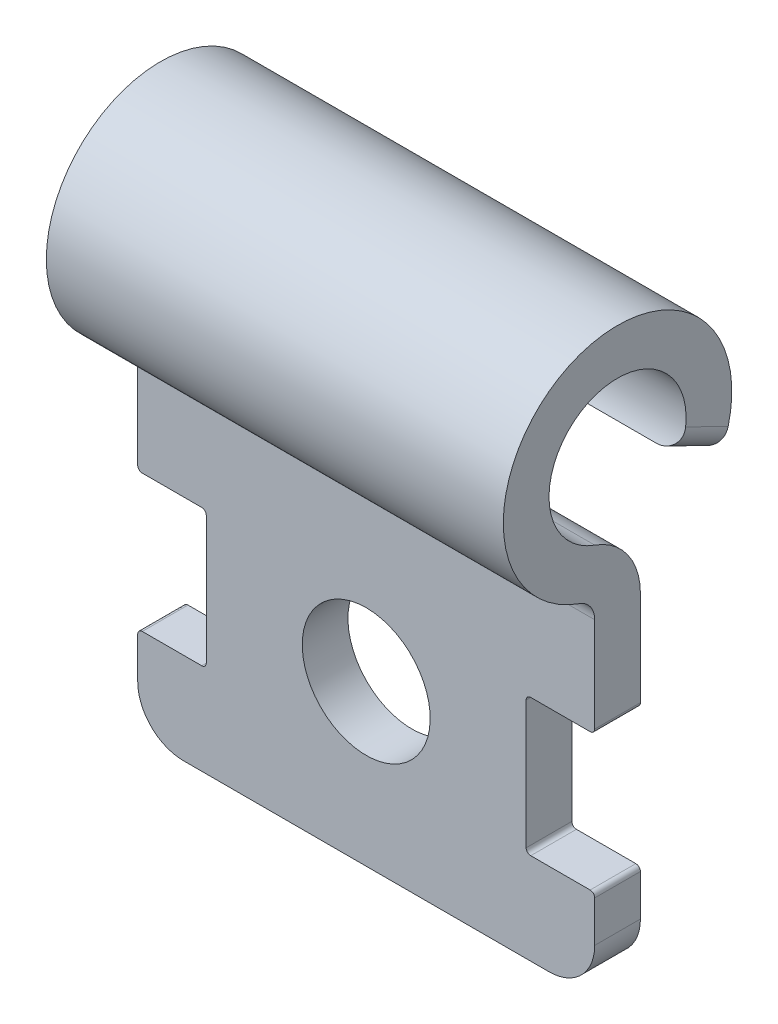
SolidWorks part; units mm, degrees
ref_plane "Front Plane" through (0, 0, 0) normal (0, 0, 1) x (1, 0, 0)
ref_plane "Top Plane" through (0, 0, 0) normal (0, 1, 0) x (1, 0, 0)
ref_plane "Right Plane" through (0, 0, 0) normal (1, 0, 0) x (0, 0, -1)
sketch "Sketch1" plane through (0, 0, 0) normal (1, 0, 0) x (0, 0, -1)
  line L1 (-0.5, -2.8284) -> (-0.5, -10)
  arc A0 (2.247, -1.0959) -> (-0.8333, -2.357) centre (0, 0) ccw
  arc A1 (-0.5, -2.8284) -> (-0.8333, -2.357) centre (-1, -2.8284) ccw
  point P5 (2.247, -1.0959)
  dimension "D" = 5
  dimension "D4" = 0.5
  dimension "C" = 10
  dimension "t/2" = 0.5
extrude "Extrude-Thin1" add sketch "Sketch1" along normal blind 10 thin
sketch "Sketch2" plane through (0, 0, -0.5) normal (0, 0, -1) x (-1, 0, 0)
  line L0 (-5, -10) -> (-5, -4.3792) construction
  line L1 (-10, -10) -> (0, -10) construction
  circle A1 centre (-5, -6.5) radius 1.4
  dimension "D3" = 2.8
  dimension "E" = 6.5
extrude "Cut-Extrude1" cut sketch "Sketch2" against normal through all
sketch "Sketch3" plane through (0, 0, 0.5) normal (0, 0, 1) x (1, 0, 0)
  line L0 (0, -2.8284) -> (0, -10) construction
  line L1 (0, -8) -> (1.5, -8)
  line L2 (0, -8) -> (0, -5)
  line L3 (0, -5) -> (1.5, -5)
  line L4 (1.5, -8) -> (1.5, -5)
  line L5 (5, -2.6931) -> (5, -7.2015) construction
  line L6 (1.5, -6.5) -> (8.5, -6.5) construction
  line L7 (8.5, -8) -> (8.5, -5)
  line L8 (10, -5) -> (8.5, -5)
  line L9 (10, -8) -> (10, -5)
  line L10 (10, -8) -> (8.5, -8)
  point P11 (1.5, -6.5)
  point P16 (8.5, -6.5)
  dimension "X" = 1.5
  dimension "Y" = 3
extrude "Cut-Extrude2" cut sketch "Sketch3" against normal through all
fillet "Fillet1" radius 0.5 2 edges at (0, -0.8767, -1.7976) (10, -0.8767, -1.7976)
fillet "Fillet2" radius 1 2 edges at (10, -10, 0) (0, -10, 0)
fillet "Fillet3" radius 0.1 8 edges at (10, -8, 0) (8.5, -8, 0) (8.5, -5, 0) (10, -5, 0) (0, -8, 0) (1.5, -8, 0) (1.5, -5, 0) (0, -5, 0)
